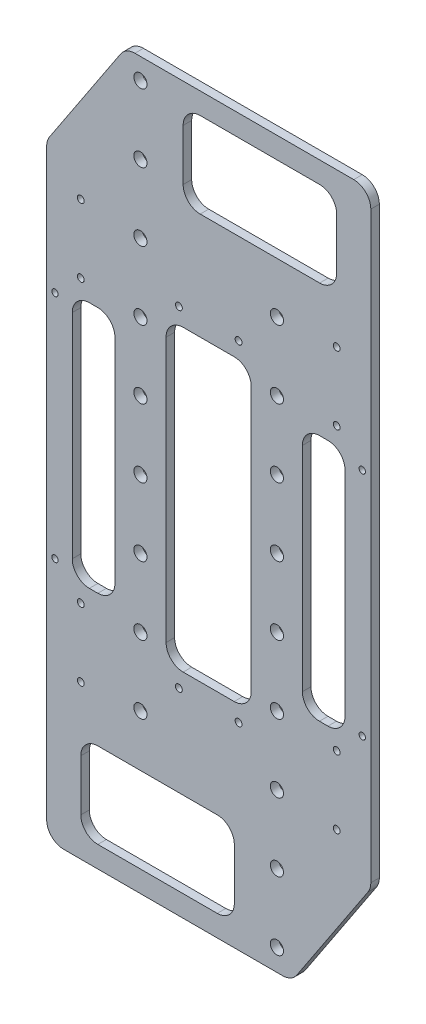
SolidWorks part; units mm, degrees
ref_plane "Front" through (0, 0, 0) normal (0, 0, 1) x (1, 0, 0)
ref_plane "Top" through (0, 0, 0) normal (0, 1, 0) x (1, 0, 0)
ref_plane "Right" through (0, 0, 0) normal (1, 0, 0) x (0, 0, -1)
sketch "Sketch1" plane through (0, 0, 0) normal (0, 0, 1) x (1, 0, 0)
  line L0 (0, 450.85) -> (58.8772, 539.75) construction
  line L1 (0, 0) -> (241.3, 0) construction
  line L2 (0, 0) -> (0, 539.75) construction
  line L3 (0, 539.75) -> (241.3, 539.75) construction
  line L4 (241.3, 0) -> (241.3, 539.75) construction
  line L5 (101.6, 523.875) -> (215.9, 523.875)
  line L6 (25.4, 79.375) -> (139.7, 79.375)
  line L7 (182.4228, 0) -> (241.3, 88.9) construction
  line L8 (0, 0) -> (0, 450.85)
  line L9 (0, 450.85) -> (58.8772, 539.75)
  line L10 (58.8772, 539.75) -> (241.3, 539.75)
  line L11 (25.4, 79.375) -> (25.4, 15.875)
  line L12 (241.3, 539.75) -> (241.3, 88.9)
  line L13 (241.3, 88.9) -> (182.4228, 0)
  line L14 (182.4228, 0) -> (0, 0)
  line L15 (25.4, 15.875) -> (139.7, 15.875)
  line L16 (120.5817, 539.75) -> (120.5817, -15.8136) construction
  line L17 (139.7, 79.375) -> (139.7, 15.875)
  line L18 (101.6, 523.875) -> (101.6, 460.375)
  line L19 (101.6, 460.375) -> (215.9, 460.375)
  line L20 (215.9, 523.875) -> (215.9, 460.375)
  line L25 (152.2633, 381) -> (88.9, 381)
  line L26 (88.9, 381) -> (88.9, 158.75)
  line L27 (152.2633, 381) -> (152.2633, 158.75)
  line L28 (88.9, 158.75) -> (152.2633, 158.75)
  line L29 (190.3633, 361.95) -> (222.1133, 361.95)
  line L30 (50.8, 361.95) -> (19.05, 361.95)
  line L31 (222.1133, 361.95) -> (222.1133, 177.8)
  line L32 (19.05, 361.95) -> (19.05, 177.8)
  line L33 (222.1133, 177.8) -> (190.3633, 177.8)
  line L34 (19.05, 177.8) -> (50.8, 177.8)
  line L35 (190.3633, 177.8) -> (190.3633, 361.95)
  line L36 (50.8, 177.8) -> (50.8, 361.95)
  line L37 (0, 225.425) -> (268.011, 225.425) construction
  line L38 (241.1633, 225.425) -> (-26.8476, 225.425) construction
  point P30 (120.5817, 381)
  point P33 (120.5817, 158.75)
  dimension "D1" = 241.3
  dimension "D2" = 539.75
  dimension "D3" = 88.9
  dimension "D4" = 15.875
  dimension "D5" = 63.5
  dimension "D6" = 114.3
  dimension "D7" = 58.8772
  dimension "D8" = 58.8772
  dimension "D9" = 88.9
  dimension "D10" = 19.05
  dimension "D11" = 31.75
  dimension "D12" = 177.8
  dimension "D13" = 184.15
  dimension "D14" = 25.4
  dimension "D15" = 114.3
  dimension "D16" = 15.875
  dimension "D17" = 25.4
  dimension "D18" = 63.5
  dimension "D19" = 158.75
  dimension "D20" = 158.75
  dimension "D22" = 88.9
sketch "Sketch4" plane through (0, 0, 0) normal (0, 0, 1) x (1, 0, 0)
  line L0 (120.5817, 539.75) -> (120.5817, -52.7718) construction
  line L1 (58.8772, 539.75) -> (241.3, 539.75) construction
  circle A0 centre (69.7817, 524.1544) radius 4.9022
  circle A3 centre (171.3817, 422.5544) radius 4.9022
  circle A4 centre (171.3817, 371.7544) radius 4.9022
  circle A5 centre (171.3817, 320.9544) radius 4.9022
  circle A6 centre (171.3817, 270.1544) radius 4.9022
  circle A7 centre (171.3817, 219.3544) radius 4.9022
  circle A8 centre (171.3817, 168.5544) radius 4.9022
  circle A9 centre (171.3817, 117.7544) radius 4.9022
  circle A10 centre (171.3817, 66.9544) radius 4.9022
  circle A11 centre (171.3817, 16.1544) radius 4.9022
  circle A34 centre (69.7817, 473.3544) radius 4.9022
  circle A36 centre (69.7817, 422.5544) radius 4.9022
  circle A38 centre (69.7817, 371.7544) radius 4.9022
  circle A40 centre (69.7817, 320.9544) radius 4.9022
  circle A42 centre (69.7817, 270.1544) radius 4.9022
  circle A44 centre (69.7817, 219.3544) radius 4.9022
  circle A46 centre (69.7817, 168.5544) radius 4.9022
  circle A48 centre (69.7817, 117.7544) radius 4.9022
  circle A64 centre (171.3817, 524.1544) radius 4.9022
  circle A65 centre (171.3817, 473.3544) radius 4.9022
  circle A66 centre (69.7817, 16.1544) radius 4.9022
  circle A67 centre (69.7817, 66.9544) radius 4.9022
  dimension "D1" = 9.8044
  dimension "D3" = 2
  dimension "D5" = 50.8
  dimension "D2" = 15.5956
  dimension "D4" = 11
extrude "Boss-Extrude1" add sketch "Sketch1" along normal blind 6.35
extrude "Cut-Extrude2" cut sketch "Sketch4" along normal through all
hole_wizard "1/4-20 Tapped Hole1" positions "Sketch5" profile "Sketch6" tap size "1/4-20" standard "ANSI Inch"
sketch "Sketch5" plane through (0, 0, 6.35) normal (0, 0, 1) x (1, 0, 0)
  point P0 (98.425, 146.8438)
  point P3 (142.875, 146.8438)
  point P6 (98.425, 392.9062)
  point P9 (142.875, 392.9062)
sketch "Sketch6" plane through (98.425, 146.8438, 6.35) normal (1, 0, 0) x (0, -1, 0)
  line L0 (0, 0) -> (0, 6.35)
  line L1 (0, 6.35) -> (2.5527, 6.35)
  line L2 (2.5527, 6.35) -> (2.5527, 0)
  line L5 (2.5527, 0) -> (0, 0)
  line L11 (0, -6.35) -> (0, 107.95) construction
  dimension "Thru Tap Drill Dia." = 5.1054
  dimension "Thru Tap Drill Depth" = 6.35
fillet "Fillet1" radius 12.7 26 edges at (0, 0, 3.175) (25.4, 15.875, 3.175) (25.4, 79.375, 3.175) (139.7, 79.375, 3.175) (139.7, 15.875, 3.175) (182.4228, 0, 3.175) (241.3, 88.9, 3.175) (19.05, 177.8, 3.175) (50.8, 177.8, 3.175) (88.9, 158.75, 3.175) (152.2633, 158.75, 3.175) (190.3633, 177.8, 3.175) (222.1133, 177.8, 3.175) (222.1133, 361.95, 3.175) (190.3633, 361.95, 3.175) (152.2633, 381, 3.175) (88.9, 381, 3.175) (0, 450.85, 3.175) (50.8, 361.95, 3.175) (19.05, 361.95, 3.175) (215.9, 460.375, 3.175) (241.3, 539.75, 3.175) (215.9, 523.875, 3.175) (101.6, 460.375, 3.175) (101.6, 523.875, 3.175) (58.8772, 539.75, 3.175)
sketch "Sketch7" plane through (0, 0, 6.35) normal (0, 0, 1) x (1, 0, 0)
  point P0 (12.7, 430.2125)
  point P1 (38.1, 430.2125)
  point P3 (38.1, 379.4125)
  point P5 (12.7, 379.4125)
  point P7 (203.2, 430.2125)
  point P9 (228.6, 430.2125)
  point P11 (203.2, 379.4125)
  point P13 (228.6, 379.4125)
  point P15 (38.1, 109.5375)
  point P17 (12.7, 109.5375)
  point P19 (12.7, 160.3375)
  point P21 (38.1, 160.3375)
  point P23 (203.2, 109.5375)
  point P25 (228.6, 109.5375)
  point P27 (228.6, 160.3375)
  point P29 (203.2, 160.3375)
hole_wizard "#10-32 Tapped Hole1" positions "Sketch8" profile "Sketch9" tap size "#10-32" standard "ANSI Inch"
sketch "Sketch8" plane through (0, 0, 6.35) normal (0, 0, 1) x (1, 0, 0)
  point P0 (12.7, 430.2125)
  point P3 (38.1, 430.2125)
  point P6 (38.1, 379.4125)
  point P9 (12.7, 379.4125)
  point P12 (203.2, 379.4125)
  point P15 (228.6, 379.4125)
  point P18 (228.6, 430.2125)
  point P21 (203.2, 430.2125)
  point P24 (12.7, 109.5375)
  point P27 (38.1, 109.5375)
  point P30 (38.1, 160.3375)
  point P33 (12.7, 160.3375)
  point P36 (203.2, 109.5375)
  point P39 (228.6, 109.5375)
  point P42 (228.6, 160.3375)
  point P45 (203.2, 160.3375)
sketch "Sketch9" plane through (12.7, 430.2125, 6.35) normal (1, 0, 0) x (0, -1, 0)
  line L0 (0, 0) -> (0, 6.35)
  line L1 (0, 6.35) -> (2.0193, 6.35)
  line L2 (2.0193, 6.35) -> (2.0193, 0)
  line L5 (2.0193, 0) -> (0, 0)
  line L11 (0, -6.35) -> (0, 107.95) construction
  dimension "Thru Tap Drill Dia." = 4.0386
  dimension "Thru Tap Drill Depth" = 6.35
hole_wizard "1/4-20 Tapped Hole2" positions "Sketch10" profile "Sketch11" tap size "1/4-20" standard "ANSI Inch"
sketch "Sketch10" plane through (0, 0, 6.35) normal (0, 0, 1) x (1, 0, 0)
  point P0 (25.4, 425.45)
  point P3 (25.4, 374.65)
  point P6 (215.9, 374.65)
  point P9 (215.9, 425.45)
  point P12 (215.9, 165.1381)
  point P15 (215.9, 114.3381)
  point P18 (25.4, 114.3)
  point P21 (25.4, 165.1)
sketch "Sketch11" plane through (25.4, 425.45, 6.35) normal (1, 0, 0) x (0, -1, 0)
  line L0 (0, 0) -> (0, 6.35)
  line L1 (0, 6.35) -> (2.5527, 6.35)
  line L2 (2.5527, 6.35) -> (2.5527, 0)
  line L5 (2.5527, 0) -> (0, 0)
  line L11 (0, -6.35) -> (0, 107.95) construction
  dimension "Thru Tap Drill Dia." = 5.1054
  dimension "Thru Tap Drill Depth" = 6.35
hole_wizard "3/16 (0.1875) Diameter Hole1" positions "Sketch12" profile "Sketch13" hole size "3/16" standard "ANSI Inch"
sketch "Sketch12" plane through (0, 0, 6.35) normal (0, 0, 1) x (1, 0, 0)
  line L0 (120.5817, 158.75) -> (120.5817, 381) construction
  line L1 (101.6, 158.75) -> (139.5633, 158.75) construction
  line L2 (139.5633, 381) -> (101.6, 381) construction
  line L3 (203.0633, 177.8) -> (209.4133, 177.8) construction
  line L4 (241.3, 92.7242) -> (241.3, 527.05) construction
  line L5 (209.4133, 361.95) -> (203.0633, 361.95) construction
  point P0 (234.95, 184.15)
  point P2 (234.95, 355.6)
  point P19 (6.2133, 355.6)
  point P20 (6.2133, 184.15)
  dimension "D1" = 6.35
  dimension "D2" = 6.35
  dimension "D3" = 6.35
sketch "Sketch13" plane through (234.95, 184.15, 6.35) normal (1, 0, 0) x (0, -1, 0)
  line L0 (0, 0) -> (0, 6.35)
  line L1 (0, 6.35) -> (2.3812, 6.35)
  line L2 (2.3812, 6.35) -> (2.3812, 0)
  line L5 (2.3812, 0) -> (0, 0)
  line L11 (0, -6.35) -> (0, 107.95) construction
  dimension "Thru Hole Dia." = 4.7625
  dimension "Thru Hole Depth" = 6.35
